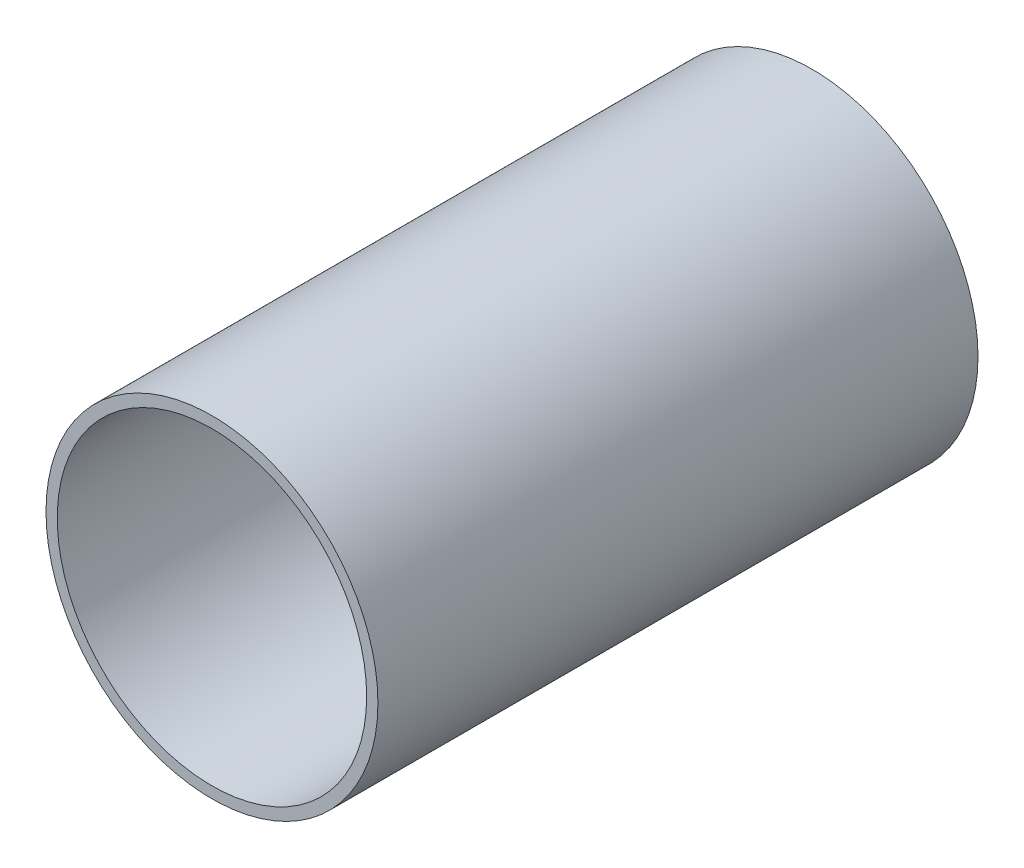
SolidWorks part; units mm, degrees
ref_plane "Front Plane" through (0, 0, 0) normal (0, 0, 1) x (1, 0, 0)
ref_plane "Top Plane" through (0, 0, 0) normal (0, 1, 0) x (1, 0, 0)
ref_plane "Right Plane" through (0, 0, 0) normal (1, 0, 0) x (0, 0, -1)
sketch "Sketch1" plane through (0, 0, 0) normal (0, 0, 1) x (1, 0, 0)
  circle A0 centre (0, 0) radius 52.3875
  circle A1 centre (0, 0) radius 56.1975
  dimension "D1" = 104.775
  dimension "D2" = 3.81
extrude "Boss-Extrude1" add sketch "Sketch1" against normal blind 203.2
